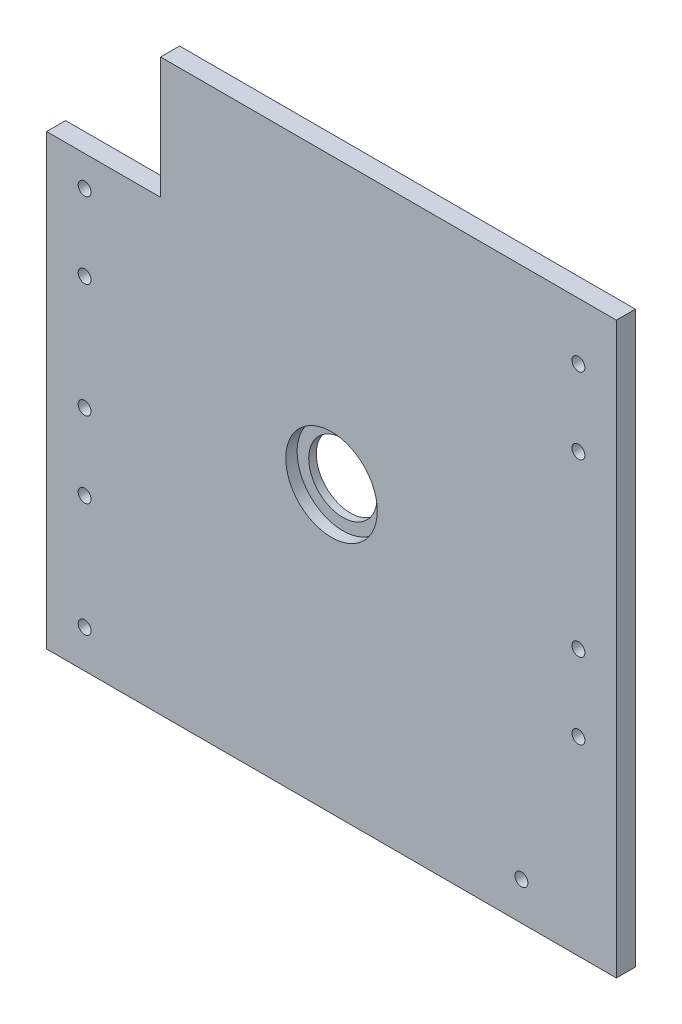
SolidWorks part; units mm, degrees
ref_plane "前视基准面" through (0, 0, 0) normal (0, 0, 1) x (1, 0, 0)
ref_plane "上视基准面" through (0, 0, 0) normal (0, 1, 0) x (1, 0, 0)
ref_plane "右视基准面" through (0, 0, 0) normal (1, 0, 0) x (0, 0, -1)
other "Configuration Table"
sketch "草图1" plane through (0, 0, 0) normal (0, 0, 1) x (1, 0, 0)
  line L1 (-75, 75) -> (75, 75)
  line L2 (-75, 75) -> (-75, -75)
  line L3 (-75, -75) -> (75, -75)
  line L4 (75, 75) -> (75, -75)
  line L5 (-75, 75) -> (75, -75) construction
  line L6 (-75, -75) -> (75, 75) construction
  point P0 (0, 0)
  dimension "D1" = 150
  dimension "D2" = 150
extrude "凸台-拉伸1" add sketch "草图1" along normal blind 5
hole_wizard "M3 十字槽沉头木螺钉的锥形沉头孔1" positions "草图2" profile "草图3" countersink size "M3" standard "GB"
sketch "草图2" plane through (0, 0, 0) normal (0, 0, -1) x (-1, 0, 0)
  line L0 (75, 75) -> (75, -75) construction
  line L1 (75, -75) -> (-75, -75) construction
  line L2 (-75, -75) -> (-75, 75) construction
  line L3 (-75, 75) -> (75, 75) construction
  line L5 (45, 75) -> (75, 75)
  line L6 (45, 75) -> (45, 43)
  line L7 (45, 43) -> (75, 43)
  line L8 (75, 75) -> (75, 43)
  point P0 (65, 35)
  point P2 (65, 15)
  point P4 (65, -15)
  point P6 (65, -35)
  point P8 (65, -65)
  point P14 (-65, 60)
  point P16 (-65, 40)
  point P18 (-65, -5)
  point P20 (-65, -25)
  point P22 (-50, -65)
  dimension "D1" = 10
  dimension "D2" = 10
  dimension "D3" = 10
  dimension "D4" = 10
  dimension "D5" = 10
  dimension "D6" = 10
  dimension "D9" = 10
  dimension "D10" = 25
  dimension "D13" = 10
  dimension "D14" = 10
  dimension "D15" = 10
  dimension "D16" = 10
  dimension "D17" = 15
  dimension "D18" = 20
  dimension "D19" = 80
  dimension "D20" = 20
  dimension "D21" = 40
  dimension "D22" = 20
  dimension "D23" = 40
  dimension "D24" = 20
  dimension "D25" = 32
  dimension "D26" = 30
sketch "草图3" plane through (-65, 35, 0) normal (1, 0, 0) x (0, 1, 0)
  line L0 (0, 0) -> (0, 12.5215)
  line L1 (0, 12.5215) -> (1.7, 11.5)
  line L2 (1.7, 11.5) -> (1.7, 1.6)
  line L3 (1.7, 1.6) -> (3.3, 0)
  line L5 (3.3, 0) -> (0, 0)
  line L6 (-1.7, 1.6) -> (-3.3, 0) construction
  line L10 (0, 12.5215) -> (-1.7, 11.5) construction
  line L11 (0, -6.35) -> (0, 107.95) construction
  dimension "孔直径" = 3.4
  dimension "孔深度" = 11.5
  dimension "近端锥形沉头孔直径" = 6.6
  dimension "近端锥形沉头孔角度" = 90
  dimension "导头角度" = 118
sketch "草图4" plane through (0, 0, 0) normal (0, 0, -1) x (-1, 0, 0)
  circle A0 centre (0, 0) radius 9
  dimension "D1" = 18
extrude "切除-拉伸1" cut sketch "草图4" against normal blind 5
sketch "草图5" plane through (0, 0, 5) normal (0, 0, 1) x (1, 0, 0)
  circle A0 centre (0, 0) radius 12.05
  dimension "D1" = 24.1
extrude "切除-拉伸2" cut sketch "草图5" against normal blind 3
sketch "草图6" plane through (0, 0, 0) normal (0, 0, -1) x (-1, 0, 0)
  line L0 (-75, 75) -> (75, 75) construction
  line L1 (45, 75) -> (75, 75)
  line L2 (45, 75) -> (45, 43)
  line L3 (45, 43) -> (75, 43)
  line L4 (75, 75) -> (75, 43)
  line L5 (75, 75) -> (75, -75) construction
  dimension "D1" = 32
  dimension "D2" = 30
extrude "切除-拉伸3" cut sketch "草图6" against normal through all
